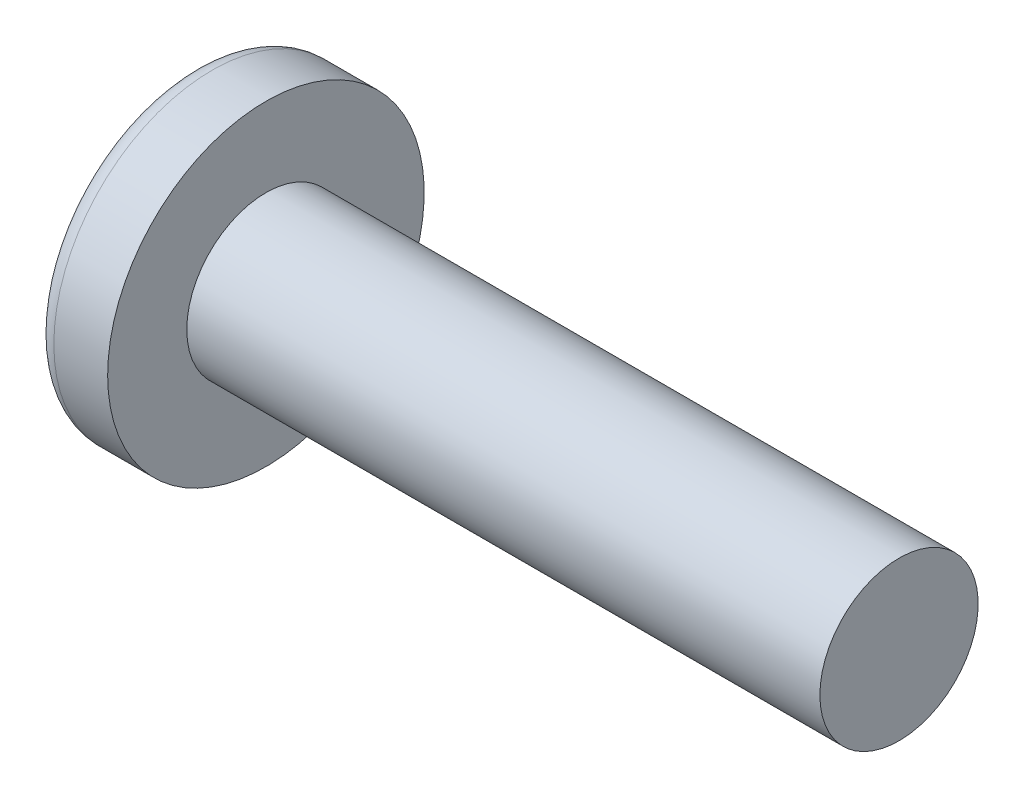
SolidWorks part; units mm, degrees
ref_plane "Plane1" through (0, 0, 0) normal (0, 0, 1) x (1, 0, 0)
ref_plane "Plane2" through (0, 0, 0) normal (0, 1, 0) x (1, 0, 0)
ref_plane "Plane3" through (0, 0, 0) normal (1, 0, 0) x (0, 0, -1)
sketch "BodySke" plane through (0, 0, 0) normal (0, 0, 1) x (1, 0, 0)
  line L0 (7.5, 5) -> (7.5, 10)
  line L1 (9, 6.35) -> (9, -3.175) construction
  line L2 (-25.4, 0) -> (127, 0) construction
  line L3 (47.5, 0) -> (0, 0)
  line L4 (7.5, 5) -> (47.5, 5)
  line L5 (47.5, 5) -> (47.5, 0)
  line L6 (4.1004, 10) -> (7.5, 10)
  line L7 (7.5, -5) -> (47.5, -5) construction
  line L8 (7.5, 6.35) -> (7.5, -3.175) construction
  arc A0 (3.1356, 9.5135) -> (0, 0) centre (16, 0) ccw
  arc A2 (3.1356, 9.5135) -> (4.1004, 10) centre (4.1004, 8.8) cw
  dimension "Head_fillet_rad" = 1.2
  dimension "Head_crown_rad" = 16
  dimension "Head_ht" = 7.5
  dimension "Diameter" = 10
  dimension "Length" = 40
  dimension "Head_dia" = 20
  dimension "Advance" = 1.5
  dimension "Thread_nom" = 40
revolve "Base-Revolve" add sketch "BodySke" angle 360 about L2
sketch "Sketch3" plane through (0, 0, 0) normal (1, 0, 0) x (0, 0, -1)
  line L0 (0.92, -5.09) -> (-0.92, -5.09)
  line L1 (0.92, -5.09) -> (0.92, 5.09)
  line L2 (-0.92, 5.09) -> (0.92, 5.09)
  line L3 (-0.92, 5.09) -> (-0.92, -5.09)
  dimension "D1" = 5.09
  dimension "Cross_dia" = 10.18
  dimension "D2" = 0.92
  dimension "Cross_width" = 1.84
ref_plane "Plane4" through (6.09, 0, 0) normal (1, 0, 0) x (0, 0, -1)
sketch "Sketch4" plane through (6.09, 0, 0) normal (1, 0, 0) x (0, 0, -1)
  line L0 (0.46, -0.46) -> (-0.46, -0.46)
  line L1 (0.46, -0.46) -> (0.46, 0.46)
  line L2 (-0.46, 0.46) -> (0.46, 0.46)
  line L3 (-0.46, 0.46) -> (-0.46, -0.46)
  dimension "D1" = 0.92
  dimension "D2" = 0.92
  dimension "D3" = 0.46
  dimension "D4" = 0.46
loft "Cut-Loft1" cut profiles "Sketch3", "Sketch4"
pattern_circular "CirPattern1" count 2 every 90 about axis through (0, 0, 0) along (1, 0, 0) of "Cut-Loft1"
sketch "ThdSchSke" plane through (0, 0, 0) normal (0, 0, 1) x (1, 0, 0)
  line L0 (9, -4.172) -> (8.4202, -5)
  line L1 (9, -4.172) -> (9.5798, -5)
  line L2 (9.5798, -5) -> (9.5798, -6.25)
  line L3 (-3.175, 0) -> (5.1513, 0) construction
  line L5 (9.5798, -6.25) -> (8.4202, -6.25)
  line L6 (8.4202, -6.25) -> (8.4202, -5)
  dimension "Thread_minor" = 8.344
  dimension "Diameter" = 10
  dimension "Start" = 9
  dimension "SideAngle" = 55
  dimension "VeeAngle" = 70
  dimension "Overcut" = 12.5
revolve "ThreadSchematic" [suppressed] cut sketch "ThdSchSke" angle 360 about L3
pattern_linear "ThdSchPat" [suppressed]
equation "\"D1@Sketch3\" = \"Cross_dia@Sketch3\" / 2"
equation "\"D2@Sketch3\" = \"Cross_width@Sketch3\" / 2"
equation "\"D1@Sketch4\" = \"Cross_width@Sketch3\" *.5"
equation "\"D2@Sketch4\" = \"D1@Sketch4\""
equation "\"D3@Sketch4\" = \"D1@Sketch4\" / 2"
equation "\"D4@Sketch4\" = \"D2@Sketch4\" / 2"
equation "\"Thread_length@ThreadCosmetic\" = ((sgn( (\"Length@BodySke\" - \"Advance@BodySke\" ) - \"Thread_nom@BodySke\" )-1)*( (\"Length@BodySke\" - \"Advance@BodySke\" ) - \"Thread_nom@BodySke\" ))/-2+ \"Thread_nom@BodySke\""
equation "\"Thread_minor@ThdSchSke\" = \"Thread_minor@ThreadCosmetic\""
equation "\"Diameter@ThdSchSke\" = \"Diameter@BodySke\""
equation "\"Overcut@ThdSchSke\" = \"Diameter@BodySke\" * 1.25"
equation "\"Start@ThdSchSke\" = \"Head_ht@BodySke\" + \"Length@BodySke\" - \"Thread_length@ThreadCosmetic\"  '---Non-countersunk---"
equation "\"Num_threads@ThdSchPat\" = int( \"Thread_length@ThreadCosmetic\" / \"Advance@BodySke\" + 0.999 )  + 1"
equation "\"Advance@ThdSchPat\" = \"Thread_length@ThreadCosmetic\" /  (\"Num_threads@ThdSchPat\" - 1) 'relax it"
